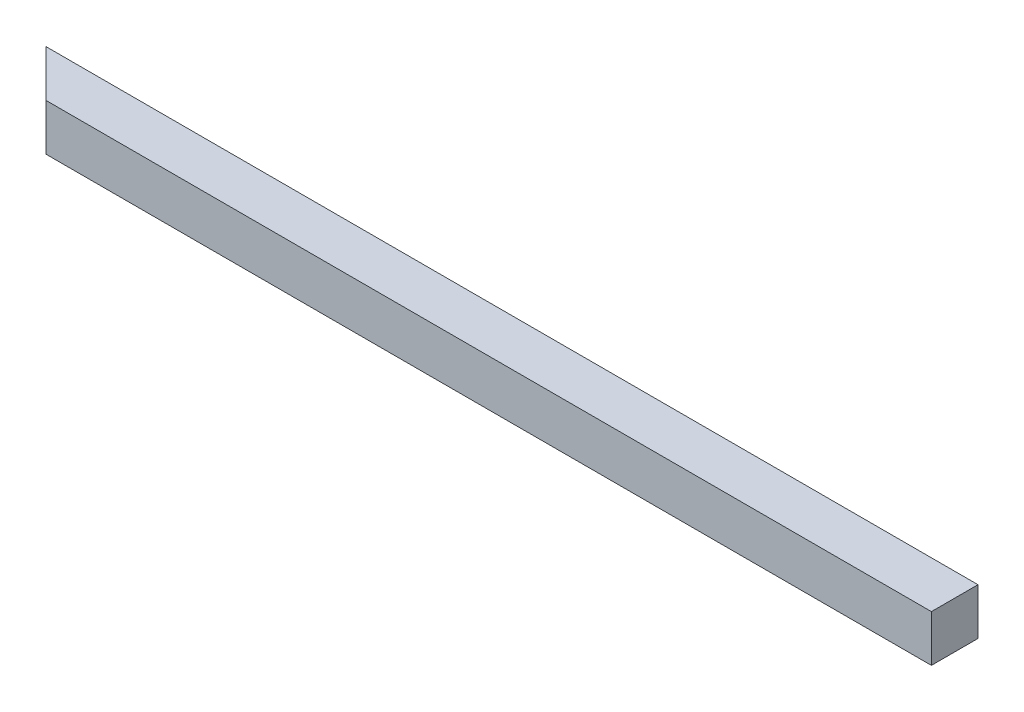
SolidWorks part; units mm, degrees
ref_plane "Front Plane" through (0, 0, 0) normal (0, 0, 1) x (1, 0, 0)
ref_plane "Top Plane" through (0, 0, 0) normal (0, 1, 0) x (1, 0, 0)
ref_plane "Right Plane" through (0, 0, 0) normal (1, 0, 0) x (0, 0, -1)
sketch "Sketch1" plane through (0, 0, 0) normal (0, 1, 0) x (1, 0, 0)
  line L0 (-200, 10) -> (-180, -10)
  line L1 (-200, 10) -> (200, 10)
  line L3 (-180, -10) -> (200, -10)
  line L4 (200, 10) -> (200, -10)
  line L5 (-200, 10) -> (200, -10) construction
  line L6 (-200, -10) -> (200, 10) construction
  point P1 (0, 0)
  dimension "D1" = 400
  dimension "D2" = 20
  dimension "D3" = 45
extrude "Boss-Extrude1" add sketch "Sketch1" along normal blind 20
